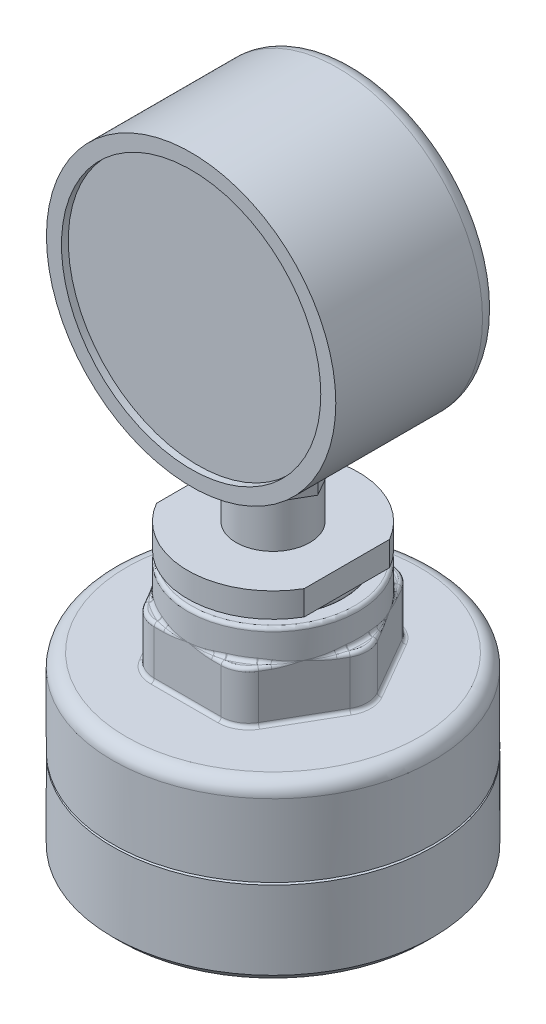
SolidWorks part; units mm, degrees
ref_plane "Front Plane" through (0, 0, 0) normal (0, 0, 1) x (1, 0, 0)
ref_plane "Top Plane" through (0, 0, 0) normal (0, 1, 0) x (1, 0, 0)
ref_plane "Right Plane" through (0, 0, 0) normal (1, 0, 0) x (0, 0, -1)
sketch "Sketch1" plane through (0, 0, 0) normal (0, 1, 0) x (1, 0, 0)
  circle A0 centre (0, 0) radius 29.845
  dimension "D1" = 59.69
extrude "Boss-Extrude1" add sketch "Sketch1" along normal blind 32.512
chamfer "Chamfer1" distance 1.524 angle 45 1 edges at (0, 0, 29.845)
sketch "Sketch2" plane through (0, 0, 0) normal (0, 1, 0) x (1, 0, 0)
  line L0 (0, 0) -> (-29.845, 0) construction
  circle A0 centre (0, 0) radius 29.845 construction
  circle A1 centre (0, 0) radius 22.4155 construction
  circle A2 centre (-22.4155, 0) radius 3.9624
  dimension "D1" = 44.831
  dimension "D2" = 7.9248
extrude "Cut-Extrude1" cut sketch "Sketch2" along normal blind 7.9248
pattern_circular "CirPattern1" count 2 over 360 about axis through (0, 0, 0) along (0, 1, 0) of "Cut-Extrude1"
ref_plane "Plane1" through (0, 32.512, 0) normal (0, 1, 0) x (1, 0, 0)
sketch "Sketch3" plane through (0, 32.512, 0) normal (0, 1, 0) x (1, 0, 0)
  line L1 (-18.3309, 0) -> (-9.1654, -15.875)
  line L2 (-9.1654, -15.875) -> (9.1654, -15.875)
  line L3 (9.1654, -15.875) -> (18.3309, 0)
  line L4 (18.3309, 0) -> (9.1654, 15.875)
  line L5 (9.1654, 15.875) -> (-9.1654, 15.875)
  line L6 (-9.1654, 15.875) -> (-18.3309, 0)
  circle A0 centre (0, 0) radius 15.875 construction
extrude "Boss-Extrude2" add sketch "Sketch3" along normal blind 9.525
fillet "Fillet1" radius 5.08 6 edges at (9.1654, 37.2745, 15.875) (18.3309, 37.2745, 0) (9.1654, 37.2745, -15.875) (-9.1654, 37.2745, -15.875) (-18.3309, 37.2745, 0) (-9.1654, 37.2745, 15.875)
fillet "Fillet2" radius 2.54 1 edges at (0, 32.512, 29.845)
sketch "Sketch4" plane through (0, 32.512, 0) normal (0, 1, 0) x (1, 0, 0)
  circle A0 centre (0, 0) radius 15.875
extrude "Boss-Extrude3" add sketch "Sketch4" along normal blind 15.113
fillet "Fillet5" radius 0.635 1 edges at (0, 47.625, 15.875)
fillet "Fillet6" radius 0.635 12 edges at (13.7482, 32.512, 7.9375) (8.7725, 32.512, 15.1944) (0, 32.512, 15.875) (-8.7725, 32.512, 15.1944) (-13.7482, 32.512, 7.9375) (-17.545, 32.512, 0) (-13.7482, 32.512, -7.9375) (-8.7725, 32.512, -15.1944) (0, 32.512, -15.875) (8.7725, 32.512, -15.1944) (17.545, 32.512, 0) (13.7482, 32.512, -7.9375)
fillet "Fillet7" radius 0.635 18 edges at (-12.19, 42.037, 10.6363) (-15.3063, 42.037, 5.2388) (-17.545, 42.037, 0) (-15.3063, 42.037, -5.2388) (-12.19, 42.037, -10.6363) (-8.7725, 42.037, -15.1944) (-3.1162, 42.037, -15.875) (3.1162, 42.037, -15.875) (8.7725, 42.037, -15.1944) (12.19, 42.037, -10.6363) (15.3063, 42.037, -5.2388) (17.545, 42.037, 0) (15.3063, 42.037, 5.2387) (12.19, 42.037, 10.6363) (8.7725, 42.037, 15.1944) (3.1162, 42.037, 15.875) (-3.1162, 42.037, 15.875) (-8.7725, 42.037, 15.1944)
fillet "Fillet8" radius 0.635 18 edges at (-2.2451, 42.037, 15.7154) (2.2451, 42.037, 15.7154) (7.9375, 42.037, 13.7482) (12.4874, 42.037, 9.802) (14.7325, 42.037, 5.9134) (15.875, 42.037, 0) (14.7325, 42.037, -5.9134) (12.4874, 42.037, -9.802) (7.9375, 42.037, -13.7482) (2.2451, 42.037, -15.7154) (-2.2451, 42.037, -15.7154) (-7.9375, 42.037, -13.7482) (-12.4874, 42.037, -9.802) (-14.7325, 42.037, -5.9134) (-15.875, 42.037, 0) (-14.7325, 42.037, 5.9134) (-12.4874, 42.037, 9.802) (-7.9375, 42.037, 13.7482)
ref_plane "Plane2" through (0, 53.594, 0) normal (0, 1, 0) x (1, 0, 0)
sketch "Sketch9" plane through (0, 53.594, 0) normal (0, 1, 0) x (1, 0, 0)
  line L2 (-13.7482, 7.9375) -> (-13.7482, -7.9375)
  line L3 (13.7482, -7.9375) -> (13.7482, 7.9375)
  arc A1 (-13.7482, 7.9375) -> (13.7482, 7.9375) centre (0, 0) cw
  arc A2 (-13.7482, -7.9375) -> (13.7482, -7.9375) centre (0, 0) ccw
extrude "Boss-Extrude4" add sketch "Sketch9" against normal blind 4.572 separate body
sketch "Sketch10" plane through (0, 53.594, 0) normal (0, 1, 0) x (1, 0, 0)
  circle A0 centre (0, 0) radius 11.1125
  dimension "D1" = 22.225
extrude "Boss-Extrude5" add sketch "Sketch10" against normal blind 9.525
sketch "Sketch11" plane through (0, 0, 0) normal (0, 1, 0) x (1, 0, 0)
  circle A0 centre (0, 0) radius 6.858
  dimension "D1" = 13.716
extrude "Boss-Extrude6" add sketch "Sketch11" along normal blind 93.726
sketch "Sketch12" plane through (0, 0, 0) normal (0, 0, 1) x (1, 0, 0)
  line L0 (6.858, 93.726) -> (-6.858, 93.726) construction
  circle A0 centre (0, 93.726) radius 26.924
  dimension "D1" = 53.848
extrude "Boss-Extrude7" add sketch "Sketch12" along normal mid plane 30.48
fillet "Fillet9" radius 3.175 1 edges at (26.924, 93.726, -15.24)
ref_plane "Plane3" through (0, 0, 15.24) normal (0, 0, 1) x (1, 0, 0)
sketch "Sketch13" plane through (0, 0, 15.24) normal (0, 0, 1) x (1, 0, 0)
  circle A0 centre (0, 93.726) radius 24.13
  dimension "D1" = 48.26
extrude "Cut-Extrude2" cut sketch "Sketch13" against normal blind 1.27
ref_plane "Plane4" through (0, 93.726, 0) normal (0, 1, 0) x (1, 0, 0)
sketch "Sketch14" plane through (0, 93.726, 0) normal (0, 1, 0) x (1, 0, 0)
  line L1 (-8.3348, 0) -> (-4.1674, -7.2181)
  line L2 (-4.1674, -7.2181) -> (4.1674, -7.2181)
  line L3 (4.1674, -7.2181) -> (8.3348, 0)
  line L4 (8.3348, 0) -> (4.1674, 7.2181)
  line L5 (4.1674, 7.2181) -> (-4.1674, 7.2181)
  line L6 (-4.1674, 7.2181) -> (-8.3348, 0)
  circle A0 centre (0, 0) radius 7.2181 construction
extrude "Boss-Extrude8" add sketch "Sketch14" against normal blind 31.75
hole_wizard "3/8 NPT Tapped Hole1" positions "Sketch16" profile "Sketch15" size "3/8" standard "ANSI Inch"
sketch "Sketch16" plane through (0, 0, 0) normal (0, 1, 0) x (1, 0, 0)
  point P0 (0, 0)
sketch "Sketch15" plane through (0, 0, 0) normal (1, 0, 0) x (0, 0, -1)
  line L0 (0, 0) -> (0, 21.8146)
  line L1 (7.1374, 17.526) -> (0, 21.8146)
  line L2 (-7.1374, 17.526) -> (0, 21.8146) construction
  line L3 (7.1374, 17.526) -> (7.1374, 10.414)
  line L4 (7.1374, 10.414) -> (7.6537, 10.414)
  line L5 (7.6537, 10.414) -> (7.9655, 0)
  line L6 (-7.6537, 10.414) -> (-7.9655, 0) construction
  line L7 (7.9655, 0) -> (0, 0)
  line L8 (0, -6.35) -> (0, 107.95) construction
  line L11 (-7.1374, 10.414) -> (-7.6537, 10.414) construction
  dimension "Tap Drill Dia." = 14.2748
  dimension "Tap Drill Depth" = 17.526
  dimension "Thread Dia." = 15.9311
  dimension "Thread Angle" = 3.43
  dimension "Thread Depth" = 10.414
  dimension "Drill Angle" = 118
sketch "Sketch17" plane through (0, 0, 0) normal (0, 0, 1) x (1, 0, 0)
  line L0 (0, 0) -> (0, 93.726) construction
  line L1 (-12.446, 47.625) -> (-12.446, 49.022) construction
  line L2 (15.24, 47.625) -> (-15.24, 47.625) construction
  line L3 (-13.7482, 49.022) -> (13.7482, 49.022) construction
  circle A0 centre (-12.446, 48.3235) radius 0.889
  dimension "D2" = 1.778
  dimension "D1" = 12.446
revolve "Revolve1" add sketch "Sketch17" angle 360 about L0
sketch "Sketch18" plane through (0, 0, 0) normal (0, 0, 1) x (1, 0, 0)
  line L0 (-30.2956, 15.8832) -> (-29.337, 16.256)
  line L1 (-29.337, 16.256) -> (-30.2956, 16.6778)
  line L2 (-30.2956, 16.6778) -> (-30.2956, 15.8832)
  line L3 (0, 0) -> (0, 29.972) construction
  line L4 (-29.845, 29.972) -> (29.845, 29.972) construction
  line L6 (-29.845, 29.972) -> (-29.845, 1.524) construction
  line L7 (-28.321, 0) -> (28.321, 0) construction
  dimension "D1" = 45
  dimension "D2" = 0.508
  dimension "D3" = 16.256
revolve "Cut-Revolve1" cut sketch "Sketch18" angle 360 about L3
